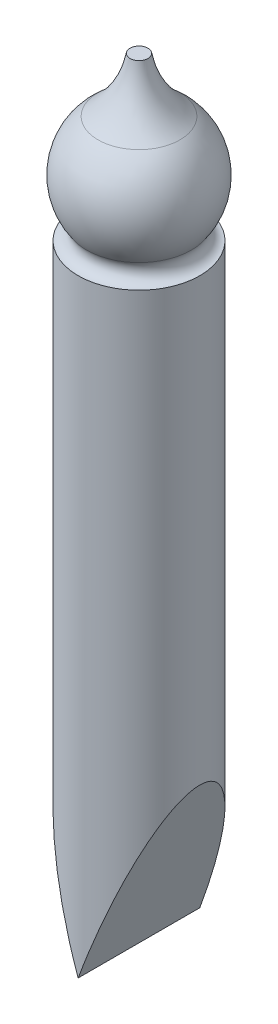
SolidWorks part; units mm, degrees
ref_plane "Front Plane" through (0, 0, 0) normal (0, 0, 1) x (1, 0, 0)
ref_plane "Top Plane" through (0, 0, 0) normal (0, 1, 0) x (1, 0, 0)
ref_plane "Right Plane" through (0, 0, 0) normal (1, 0, 0) x (0, 0, -1)
sketch "Sketch1" plane through (0, 0, 0) normal (0, 1, 0) x (1, 0, 0)
  circle A0 centre (0, 0) radius 3
  dimension "D1" = 6
extrude "Boss-Extrude1" add sketch "Sketch1" along normal blind 30
sketch "Sketch2" plane through (0, 0, 0) normal (0, 0, 1) x (1, 0, 0)
  line L0 (0, 30) -> (0, 38)
  line L1 (3, 30) -> (-3, 30) construction
  line L2 (0, 38) -> (0.4413, 38)
  line L3 (3, 30) -> (0, 30)
  arc A1 (0.4413, 38) -> (2.0193, 35.311) centre (4.7794, 38.7382) ccw
  arc A2 (2.5877, 30.888) -> (3, 30) centre (3.0357, 30.5563) ccw
  arc A3 (2.5877, 30.888) -> (2.0193, 35.311) centre (0, 32.8035) ccw
  dimension "D1" = 8
revolve "Revolve1" add sketch "Sketch2" angle 360 about L0
sketch "Sketch3" plane through (0, 0, 0) normal (0, 0, 1) x (1, 0, 0)
  line L1 (0, 0) -> (3, 8.2424)
  line L2 (0, 0) -> (-3, 8.2424)
  line L3 (-3, 30) -> (-3, 0) construction
  line L4 (-3, 8.2424) -> (-3, 0)
  line L5 (-3, 0) -> (3, 0) construction
  line L6 (-3, 0) -> (3, 0)
  line L7 (3, 0) -> (3, 30) construction
  line L8 (3, 0) -> (3, 8.2424)
extrude "Cut-Extrude3" cut sketch "Sketch3" against normal mid plane 30 contours L4 L6 L2 | L6 L8 L1
